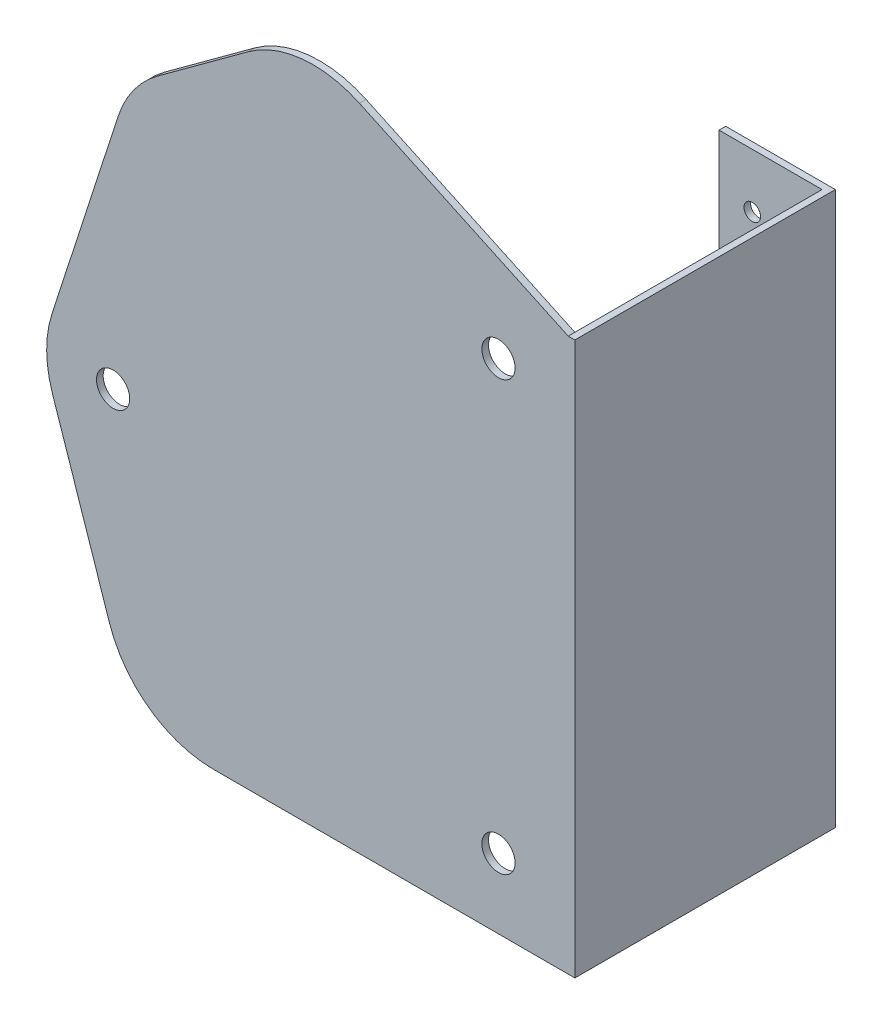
SolidWorks part; units mm, degrees
ref_plane "Plan de face" through (0, 0, 0) normal (0, 0, 1) x (1, 0, 0)
ref_plane "Plan de dessus" through (0, 0, 0) normal (0, 1, 0) x (1, 0, 0)
ref_plane "Plan de droite" through (0, 0, 0) normal (1, 0, 0) x (0, 0, -1)
sketch "Esquisse1" plane through (0, 0, 0) normal (0, 0, 1) x (1, 0, 0)
  line L0 (0, 0) -> (0, 145.3)
  line L1 (-19.0672, 175.2145) -> (-62.8672, 195.6145)
  line L2 (-96.3023, 192.3207) -> (-123.6023, 172.3207)
  line L3 (-135.4924, 155.8744) -> (-155.3924, 94.4744)
  line L4 (-155.2882, 73.8096) -> (-138.0882, 22.5096)
  line L5 (-106.8, 0) -> (0, 0)
  line L7 (0, 145.3) -> (0, 166.3339)
  line L8 (0, 166.3339) -> (-19.0672, 175.2145)
  arc A2 (-62.8672, 195.6145) -> (-96.3023, 192.3207) centre (-76.8, 165.7) ccw
  arc A3 (-123.6023, 172.3207) -> (-135.4924, 155.8744) centre (-104.1, 145.7) ccw
  arc A5 (-138.0882, 22.5096) -> (-106.8, 0) centre (-106.8, 33) ccw
  arc A8 (-155.3924, 94.4744) -> (-155.2882, 73.8096) centre (-124, 84.3) ccw
  point P3 (-33, 33)
  point P7 (-33, 145.3)
  point P10 (-106.8, 33)
  point P13 (-124, 84.3)
  point P16 (-104.1, 145.7)
  point P19 (-76.8, 165.7)
  point P31 (0, 0)
  dimension "D10" = 66
  dimension "D11" = 145.7
  dimension "D3" = 33
  dimension "D4" = 33
  dimension "D6" = 33
  dimension "D7" = 33
  dimension "D8" = 124
  dimension "D9" = 84.3
  dimension "D12" = 104.1
  dimension "D14" = 165.7
  dimension "D15" = 76.8
  dimension "D17" = 145.3
  dimension "D18" = 106.8
extrude "Boss.-Extru.1" add sketch "Esquisse1" along normal blind 2
sketch "Esquisse2" plane through (0, 0, 2) normal (0, 0, 1) x (1, 0, 0)
  line L0 (0, 0) -> (0, 166.3339) construction
  line L1 (-106.8, 0) -> (0, 0) construction
  circle A0 centre (-21, 21) radius 5
  circle A1 centre (-21, 150) radius 5
  circle A2 centre (-137, 84) radius 5
  dimension "D3" = 10
  dimension "D1" = 21
  dimension "D2" = 21
  dimension "D4" = 21
  dimension "D5" = 150
  dimension "D6" = 137
  dimension "D7" = 84
extrude "Enlèv. mat.-Extru.1" cut sketch "Esquisse2" against normal through all
sketch "Esquisse3" plane through (0, 0, 2) normal (0, 0, 1) x (1, 0, 0)
  line L1 (0, 166.3339) -> (2, 166.3339)
  line L2 (0, 166.3339) -> (0, 0)
  line L3 (0, 0) -> (2, 0)
  line L4 (2, 166.3339) -> (2, 0)
  dimension "D1" = 2
extrude "Boss.-Extru.2" add sketch "Esquisse3" against normal blind 78.4
sketch "Esquisse4" plane through (0, 0, 0) normal (-1, 0, 0) x (0, 0, 1)
  line L0 (-76.4, 166.3339) -> (0, 166.3339) construction
  line L1 (-76.4, 0) -> (-74.4, 0)
  line L2 (-76.4, 0) -> (-76.4, 166.3339)
  line L3 (-76.4, 166.3339) -> (-74.4, 166.3339)
  line L4 (-74.4, 0) -> (-74.4, 166.3339)
  dimension "D1" = 2
extrude "Boss.-Extru.3" add sketch "Esquisse4" along normal blind 31
sketch "Esquisse8" plane through (0, 0, -74.4) normal (0, 0, 1) x (1, 0, 0)
  line L0 (-31, 0) -> (0, 0) construction
  line L1 (0, 0) -> (0, 166.3339) construction
  circle A0 centre (-21, 21) radius 2.5
  circle A1 centre (-21, 150) radius 2.5
  dimension "D1" = 21
  dimension "D3" = 5
  dimension "D2" = 21
  dimension "D4" = 129
  dimension "D5" = 21
extrude "Enlèv. mat.-Extru.3" cut sketch "Esquisse8" against normal through all
